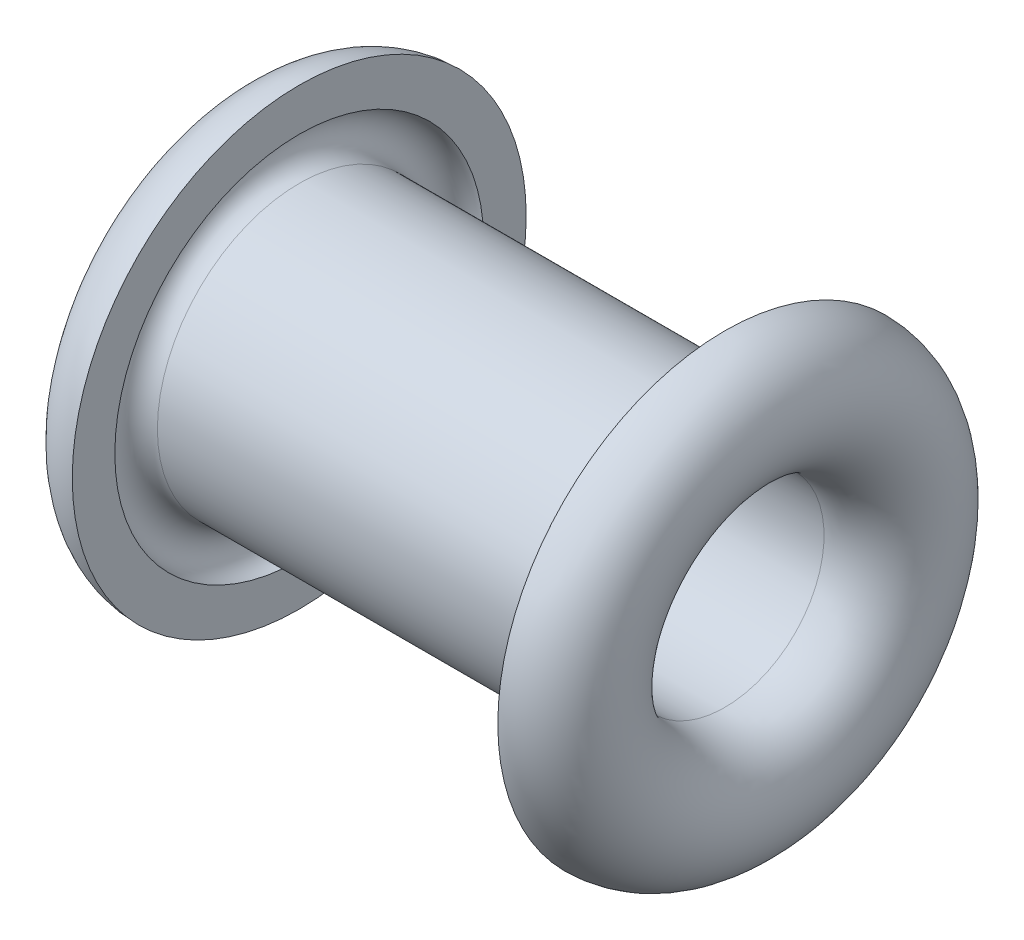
SolidWorks part; units mm, degrees
ref_plane "Plan de face" through (0, 0, 0) normal (0, 0, 1) x (1, 0, 0)
ref_plane "Plan de dessus" through (0, 0, 0) normal (0, 1, 0) x (1, 0, 0)
ref_plane "Plan de droite" through (0, 0, 0) normal (1, 0, 0) x (0, 0, -1)
sketch "Esquisse1" plane through (0, 0, 0) normal (0, 0, 1) x (1, 0, 0)
  line L0 (0, 0) -> (2.174, 0) construction
  line L1 (0, 0) -> (0, 1.8887) construction
  line L2 (0, 0.7) -> (1.5, 0.7)
  line L3 (0, 1) -> (1.5, 1)
  line L4 (0, 1.6) -> (0, 1.3)
  line L5 (1.5, 1) -> (1.5, 0.7)
  arc A0 (0, 1.6) -> (0, 0.7) centre (0, 1.15) ccw
  arc A1 (0, 1.3) -> (0, 1) centre (0, 1.15) ccw
  dimension "D3" = 0.9
  dimension "D1" = 0.3
  dimension "D2" = 1
  dimension "D4" = 1.5
  dimension "D5" = 1.5
revolve "Révolution1" add sketch "Esquisse1" angle 360 about L0
mirror "Symétrie1" about plane through (1.5, 1, 0) normal (-1, 0, 0)
